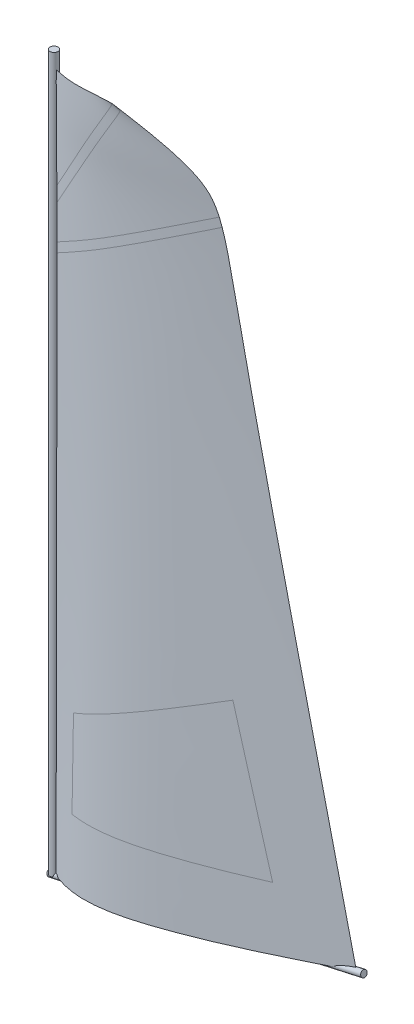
SolidWorks part; units mm, degrees
ref_plane "Plan de face" through (0, 0, 0) normal (0, 0, 1) x (1, 0, 0)
ref_plane "Plan de dessus" through (0, 0, 0) normal (0, 1, 0) x (1, 0, 0)
ref_plane "Plan de droite" through (0, 0, 0) normal (1, 0, 0) x (0, 0, -1)
sketch "Esquisse5" plane through (0, 0, 0) normal (0, 0, 1) x (1, 0, 0)
  line L0 (0, 0) -> (1952.592, 432.8792)
  line L1 (0, 0) -> (0, 4400)
  line L2 (1952.592, 432.8792) -> (1086.9185, 4142.6039)
  line L3 (484.0946, 4515.3607) -> (0, 4400)
  line L4 (0, 0) -> (3397.5594, 0) construction
  arc A0 (1086.9185, 4142.6039) -> (484.0946, 4515.3607) centre (600, 4028.9802) ccw
  point P7 (972.7609, 4631.8108)
  point P8 (1293.7931, 3256.0716)
  point P10 (1477.0384, 2470.7991)
  point P11 (1705.3004, 1492.6135)
  dimension "D1" = 1000
  dimension "D4" = 500
  dimension "D2" = 4400
  dimension "D3" = 2000
  dimension "D5" = 12.5
  dimension "D6" = 600
sketch "Esquisse2" plane through (0, 0, 0) normal (0, 1, 0) x (1, 0, 0)
  line L0 (0, 79.4639) -> (0, -146.124) construction
  circle A0 centre (0, 0) radius 25
  dimension "D1" = 50
sketch "Esquisse3" plane through (0, 0, 0) normal (0, 0, 1) x (1, 0, 0)
  point P0 (471.5366, 1149.4374)
extrude "Extrusion1" add sketch "Esquisse2" along normal blind 4500
ref_plane "Plan8" [suppressed] through (93.4427, 39.987, -421.4363) normal (0.2155, 0.0922, -0.9721) x (-0.9765, 0.0204, -0.2146)
sketch "Esquisse16" plane through (0, 0, 0) normal (0, 0, 1) x (1, 0, 0)
  line L0 (0, 0) -> (1952.592, 432.8792) construction
  point P0 (610.7393, 135.3977)
ref_plane "Plan10" through (0, 0, 0) normal (-0.9763, -0.2164, 0) x (0.2164, -0.9763, 0)
ref_plane "Plan11" through (1952.592, 432.8792, 0) normal (-0.9763, -0.2164, 0) x (0, 0, 1)
sketch "Esquisse17" plane through (1957.3899, 411.2373, 0) normal (-0.9763, -0.2164, 0) x (0, 0, -1)
  circle A0 centre (0, -22.1674) radius 20
  dimension "D1" = 40
extrude "Extrusion3" add sketch "Esquisse17" along normal blind 2025
sketch "Esquisse21" plane through (0, 0, 0) normal (0, 0, 1) x (1, 0, 0)
  line L0 (711.7814, 177.5723) -> (1032.9888, 177.5723) construction
  line L1 (877.5817, 177.5723) -> (791.9449, 177.5723)
  line L2 (791.9449, 177.5723) -> (791.9449, 143.0665)
  line L3 (791.9449, 143.0665) -> (877.5817, 143.0665)
  line L4 (877.5817, 143.0665) -> (877.5817, 177.5723)
ref_plane "Plan9" through (781.0368, 173.1517, 0) normal (-0.9763, -0.2164, 0) x (0, 0, 1)
sketch "Esquisse22" plane through (781.0368, 173.1517, 0) normal (-0.9763, -0.2164, 0) x (0, 0, 1)
  circle A0 centre (4.292, -17.4665) radius 26.3658
extrude "Extrusion4" add sketch "Esquisse22" along normal up to vertex (66.657 mm away)
sketch "Esquisse23" plane through (0, 0, 0) normal (0, 0, 1) x (1, 0, 0)
  point P0 (758.9806, 160.1924)
ref_plane "Plan12" through (0, 0, 0) normal (0.2164, -0.9763, 0) x (0.9763, 0.2164, 0)
sketch "Esquisse24" plane through (0, 0, 0) normal (0.2164, -0.9763, 0) x (0.9763, 0.2164, 0)
  line L0 (1952.2099, 0) -> (1952.0474, -0.9867) construction
  line L1 (0, 0) -> (0.4144, -0.9101) construction
  spline S0 degree 3 poles (0, 0) (63.3716, 28.8548) (324.7897, 147.8857) (1005.4085, 155.9063) (1585.1588, 60.4409) (1952.2099, 0) knots 0 0 0 0 0.105062 0.433397 1 1 1 1
  spline S1 degree 1 poles (0.4144, -0.9101) (1952.0474, -0.9867) knots 0 0 1 1 construction
  spline S2 degree 3 poles (0.4144, -0.9101) (19.2531, 7.6677) (56.9624, 24.838) (113.7916, 49.499) (161.6597, 68.266) (200.4128, 81.6578) (239.5156, 93.8437) (289.001, 106.9406) (349.2386, 119.4983) (410.2106, 129.1718) (492.3263, 138.5841) (596.2072, 144.4929) (721.8837, 144.3755) (847.6078, 139.2431) (972.4561, 131.1825) (1096.5555, 120.4573) (1219.9921, 107.4168) (1342.8636, 92.3872) (1506.0623, 70.1392) (1709.1297, 39.0136) (1871.0554, 12.3499) (1952.0474, -0.9867) knots 0 0 0 0 0.03125 0.0625 0.09375 0.109375 0.125 0.15625 0.1875 0.21875 0.25 0.3125 0.375 0.4375 0.5 0.5625 0.625 0.6875 0.75 0.875 1 1 1 1 construction
  dimension "D1" = 1
ref_plane "Plan13" through (-649.3188, 2928.888, 0) normal (0.2164, -0.9763, 0) x (0.9763, 0.2164, 0)
sketch "Esquisse25" plane through (-649.3188, 2928.888, 0) normal (0.2164, -0.9763, 0) x (0.9763, 0.2164, 0)
  line L3 (665.084, 0) -> (1966.7468, 0) construction
  line L6 (1966.7468, 40) -> (1966.6507, 39.0046) construction
  line L7 (665.084, 0) -> (665.3137, -0.9733) construction
  spline S0 degree 3 poles (665.084, 0) (761.6565, 22.7888) (1014.8795, 82.5433) (1454.9893, 89.4147) (1790.7784, 56.9913) (1966.7468, 40) knots 0 0 0 0 0.226855 0.594838 1 1 1 1
  spline S1 degree 1 poles (665.3137, -0.9733) (1966.6507, 39.0046) knots 0 0 1 1 construction
  spline S2 degree 3 poles (665.3137, -0.9733) (691.9136, 5.3037) (745.1315, 17.8617) (825.0847, 35.6767) (891.9672, 48.8264) (945.6994, 57.8267) (999.6145, 65.6236) (1067.3407, 73.1407) (1149.0098, 78.9952) (1230.9527, 82.0509) (1313.0414, 82.6853) (1395.1542, 81.2683) (1504.4796, 77.1644) (1640.7159, 68.631) (1803.7866, 54.7302) (1912.3607, 44.2468) (1966.6507, 39.0046) knots 0 0 0 0 0.0625 0.125 0.1875 0.21875 0.25 0.3125 0.375 0.4375 0.5 0.5625 0.625 0.75 0.875 1 1 1 1 construction
  dimension "D1" = 40
  dimension "D2" = 1
ref_plane "Plan14" through (-865.7585, 3905.184, 0) normal (0.2164, -0.9763, 0) x (0.9763, 0.2164, 0)
sketch "Esquisse26" plane through (-865.7585, 3905.184, 0) normal (0.2164, -0.9763, 0) x (0.9763, 0.2164, 0)
  line L0 (0, 0) -> (2000, 0) construction
  line L8 (886.7787, 0) -> (1917.6263, 0) construction
  line L11 (886.7787, 0) -> (887.085, -0.9519) construction
  line L12 (1917.6263, 80) -> (1917.5729, 79.0014) construction
  spline S0 degree 3 poles (886.7787, 0) (953.9662, 21.6205) (1114.2715, 73.2057) (1462.5463, 104.3446) (1738.824, 89.5651) (1917.6263, 80) knots 0 0 0 0 0.202914 0.484139 1 1 1 1
  spline S1 degree 1 poles (887.085, -0.9519) (1917.5729, 79.0014) knots 0 0 1 1 construction
  spline S2 degree 3 poles (887.085, -0.9519) (907.7715, 5.7049) (949.1668, 19.0262) (1011.4771, 37.8681) (1063.8169, 51.7038) (1106.0679, 61.063) (1148.5889, 69.2256) (1202.169, 77.3874) (1288.5629, 86.71) (1397.2811, 92.6342) (1527.491, 94.2013) (1657.5894, 91.4896) (1787.5961, 85.955) (1874.25, 81.319) (1917.5729, 79.0014) knots 0 0 0 0 0.0625 0.125 0.1875 0.21875 0.25 0.3125 0.375 0.5 0.625 0.75 0.875 1 1 1 1 construction
  dimension "D1" = 80
  dimension "D2" = 1
ref_plane "Plan15" through (-929.6081, 4193.1914, 0) normal (0.2164, -0.9763, 0) x (0.9763, 0.2164, 0)
sketch "Esquisse27" plane through (-929.6081, 4193.1914, 0) normal (0.2164, -0.9763, 0) x (0.9763, 0.2164, 0)
  line L0 (952.1786, 0) -> (2401.2183, 0) construction
  line L3 (1449.9225, 120) -> (1450.103, 119.0164) construction
  line L4 (952.1786, 0) -> (952.5363, -0.9338) construction
  spline S0 degree 3 poles (952.1786, 0) (1008.1752, 21.4481) (1123.2079, 65.5084) (1293.0954, 91.2242) (1402.4876, 111.2963) (1449.9225, 120) knots 0 0 0 0 0.349474 0.717917 1 1 1 1
  spline S1 degree 1 poles (952.5363, -0.9338) (1450.103, 119.0164) knots 0 0 1 1 construction
  spline S2 degree 3 poles (952.5363, -0.9338) (972.5521, 6.7327) (1012.6206, 22.081) (1063.0311, 39.8541) (1103.8013, 52.4176) (1134.6593, 60.7686) (1165.8241, 68.0152) (1207.6831, 76.5704) (1249.8789, 83.9029) (1292.1571, 90.9202) (1334.3952, 98.068) (1387.0422, 107.4484) (1429.0795, 115.1589) (1450.103, 119.0164) knots 0 0 0 0 0.125 0.25 0.3125 0.375 0.4375 0.5 0.625 0.6875 0.75 0.875 1 1 1 1 construction
  dimension "D1" = 120
  dimension "D2" = 1
curve "Courbe2"
curve "Courbe3"
curve "Courbe4"
curve "Courbe6"
surface "Surface-Lissage6"
sketch "Esquisse28" plane through (0, 0, 0) normal (0, 0, 1) x (1, 0, 0)
  line L0 (0, 3733.1767) -> (485.9454, 4507.012)
  line L1 (0, 3639.1576) -> (528.2887, 4480.4217)
  line L2 (528.2887, 4480.4217) -> (485.9454, 4507.012)
  line L3 (0, 3733.1767) -> (0, 3639.1576)
  line L7 (0, 4500) -> (0, 0) construction
  dimension "D1" = 50
sketch "Esquisse29" plane through (0, 0, 0) normal (0, 0, 1) x (1, 0, 0)
  line L0 (0, 3448.0066) -> (1220.5499, 4244.2825)
  line L1 (1220.5499, 4244.2825) -> (1247.8696, 4202.4062)
  line L2 (1247.8696, 4202.4062) -> (0, 3388.307)
  line L3 (0, 3388.307) -> (0, 3448.0066)
  line L5 (0, 4500) -> (0, 0) construction
  dimension "D1" = 50
sketch "Esquisse30" plane through (0, 0, 0) normal (0, 0, 1) x (1, 0, 0)
  line L0 (184.2708, 453.625) -> (1442.7946, 708.4181)
  line L1 (1442.7946, 708.4181) -> (1203.4434, 1588.6127)
  line L2 (1203.4434, 1588.6127) -> (184.2708, 1001.8163)
  line L3 (184.2708, 1001.8163) -> (184.2708, 453.625)
sketch "Esquisse31" plane through (0, 0, 0) normal (0, 0, 1) x (1, 0, 0)
  point P0 (414.706, 1935.823)
